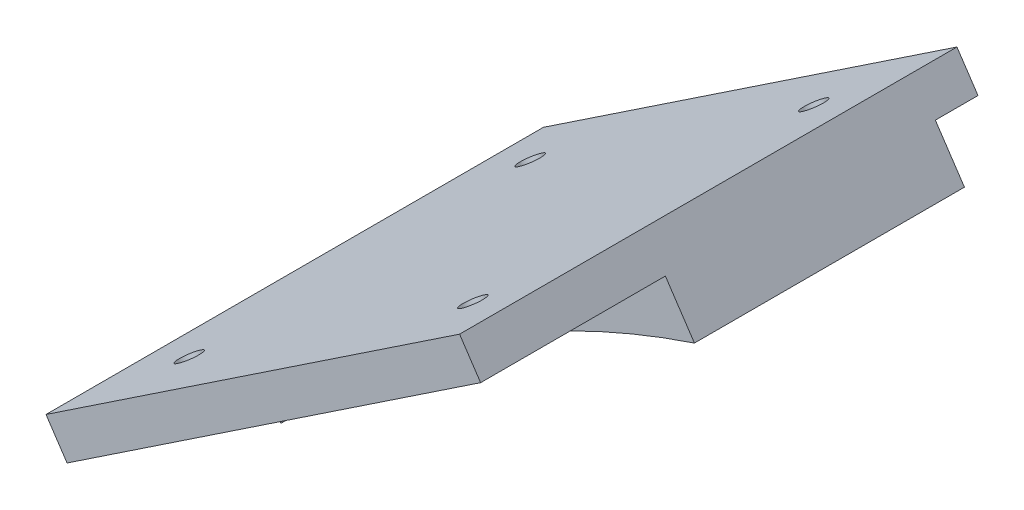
SolidWorks part; units mm, degrees
ref_plane "Front" through (0, 0, 0) normal (0, 0, 1) x (1, 0, 0)
ref_plane "Top" through (0, 0, 0) normal (0, 1, 0) x (1, 0, 0)
ref_plane "Right" through (0, 0, 0) normal (1, 0, 0) x (0, 0, -1)
imported_body "Imported1"
hole_wizard "M5x0.8 Tapped Hole1" positions "Sketch1" profile "Sketch2" tap size "M5x0.8" standard "ANSI Metric"
sketch "Sketch1" plane through (-117.2253, 175.4401, 0) normal (-0.5556, 0.8315, 0) x (0.8315, 0.5556, 0)
  line L1 (0, 218.25) -> (0, 50218.25) construction
  line L2 (52.5, 218.25) -> (-52.5, 218.25) construction
  line L3 (-52.5, 165.75) -> (-50052.5, 165.75) construction
  line L4 (-52.5, 218.25) -> (-52.5, 113.25) construction
  line L5 (-36, 201.75) -> (-36, 129.75) construction
  line L6 (-36, 129.75) -> (36, 129.75) construction
  line L7 (36, 129.75) -> (36, 201.75) construction
  line L8 (36, 201.75) -> (-36, 201.75) construction
  point P0 (-36, 201.75)
  point P9 (0, 218.25)
  point P14 (-52.5, 165.75)
  point P15 (36, 201.75)
  point P16 (36, 129.75)
  point P17 (-36, 129.75)
  dimension "D1" = 72
sketch "Sketch2" plane through (-147.1582, 155.4396, -201.75) normal (0.6393, 0.4272, 0.6393) x (-0.5316, -0.3552, 0.7689)
  line L0 (0, 0) -> (0, 17.2618)
  line L1 (0, 17.2618) -> (2.1, 16)
  line L2 (2.1, 16) -> (2.1, 12)
  line L3 (2.1, 12) -> (2.5, 12)
  line L4 (2.5, 12) -> (2.5, 0)
  line L5 (2.5, 0) -> (0, 0)
  line L10 (0, 17.2618) -> (-2.1, 16) construction
  line L11 (0, -6.35) -> (0, 107.95) construction
  dimension "Tap Drill Dia." = 4.2
  dimension "Tap Drill Depth" = 16
  dimension "Thread Major Dia." = 5
  dimension "Thread Depth" = 12
  dimension "Drill Angle" = 118
